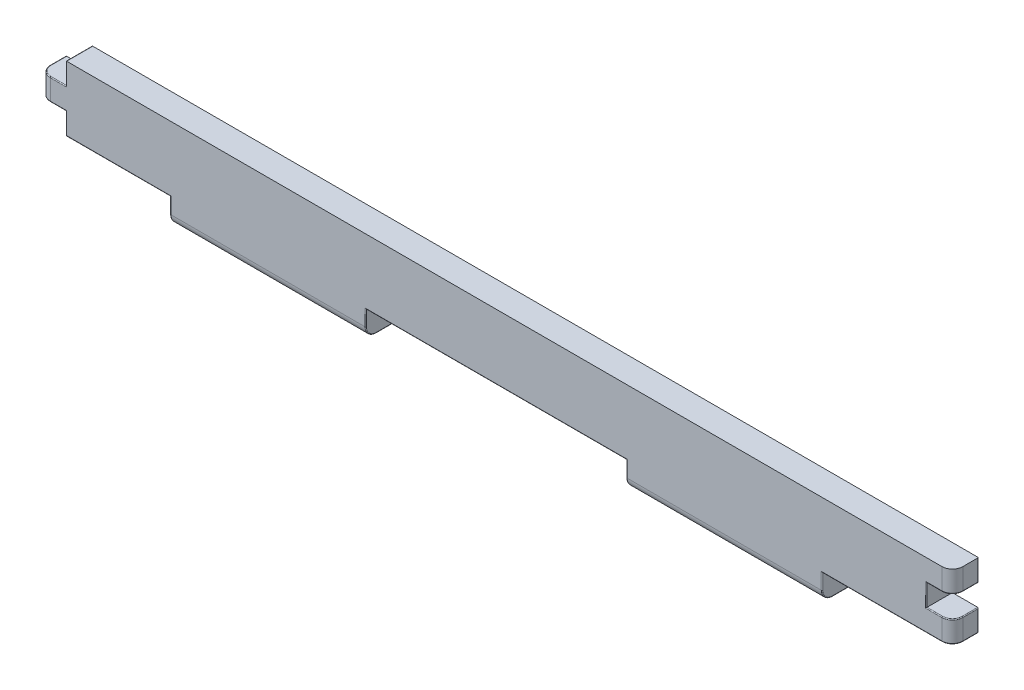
SolidWorks part; units mm, degrees
ref_plane "Front Plane" through (0, 0, 0) normal (0, 0, 1) x (1, 0, 0)
ref_plane "Top Plane" through (0, 0, 0) normal (0, 1, 0) x (1, 0, 0)
ref_plane "Right Plane" through (0, 0, 0) normal (1, 0, 0) x (0, 0, -1)
sketch "Sketch1" plane through (0, 0, 0) normal (0, 0, 1) x (1, 0, 0)
  line L1 (175, -17.5) -> (-175, -17.5)
  line L2 (175, -17.5) -> (175, 17.5)
  line L3 (175, 17.5) -> (-175, 17.5)
  line L4 (-175, -17.5) -> (-175, 17.5)
  line L5 (175, -17.5) -> (-175, 17.5) construction
  line L6 (175, 17.5) -> (-175, -17.5) construction
  point P0 (0, 0)
  dimension "D1" = 35
  dimension "D2" = 350
extrude "Boss-Extrude1" add sketch "Sketch1" along normal blind 10 contours L3 L4 L1 L2
sketch "Sketch2" plane through (0, 0, 10) normal (0, 0, 1) x (1, 0, 0)
  line L0 (175, -17.5) -> (-175, -17.5) construction
  line L1 (-175, 17.5) -> (-165, 17.5)
  line L2 (-175, 17.5) -> (-175, 9.1667)
  line L4 (-165, 17.5) -> (-165, 9.1667)
  line L5 (-175, -17.5) -> (-125, -17.5)
  line L6 (-175, -17.5) -> (-175, -7.5)
  line L7 (-175, -7.5) -> (-125, -7.5)
  line L8 (-125, -17.5) -> (-125, -7.5)
  line L9 (-50, -17.5) -> (50, -17.5)
  line L10 (-50, -17.5) -> (-50, -7.5)
  line L11 (-50, -7.5) -> (50, -7.5)
  line L12 (50, -17.5) -> (50, -7.5)
  line L13 (175, -17.5) -> (175, 17.5) construction
  line L14 (125, -17.5) -> (175, -17.5)
  line L15 (125, -17.5) -> (125, -7.5)
  line L16 (125, -7.5) -> (175, -7.5)
  line L17 (175, -17.5) -> (175, -7.5)
  line L18 (175, 17.5) -> (-175, 17.5) construction
  line L19 (-175, -7.5) -> (-165, -7.5)
  line L20 (-175, -7.5) -> (-175, 9.1667)
  line L21 (-165, 0.8333) -> (-175, 0.8333)
  line L22 (-165, -7.5) -> (-165, 0.8333)
  line L23 (175, 9.17) -> (165, 9.17)
  line L24 (175, 9.17) -> (175, 0.84)
  line L25 (175, 0.84) -> (165, 0.84)
  line L26 (165, 0.84) -> (165, 9.17)
  line L27 (-165, 9.1667) -> (-175, 9.1667)
  point P1 (175, 12.7553)
  point P6 (0, 0)
  point P11 (0, 0)
  point P12 (0, 0)
  point P18 (0, 0)
  point P22 (-50, -12.5)
  point P40 (125, -7.5)
  point P45 (-50, -7.5)
  point P48 (-125, -7.5)
  dimension "D7" = 10
  dimension "D1" = 50
  dimension "D2" = 75
  dimension "D3" = 75
  dimension "D4" = 50
  dimension "D5" = 10
  dimension "D6" = 8.3333
  dimension "D8" = 10
  dimension "D9" = 8.33
  dimension "D10" = 8.33
extrude "Cut-Extrude1" cut sketch "Sketch2" against normal through all
fillet "Fillet1" radius 4 5 edges at (175, -3.33, 10) (175, 13.335, 10) (-175, 5, 10) (87.5, -17.5, 10) (-87.5, -17.5, 10)
fillet "Fillet2" radius 0.3 36 edges at (168, 0.84, 10) (173.8284, 0.84, 8.8284) (168, 9.17, 10) (173.8284, 9.17, 8.8284) (175, -7.5, 3) (173.8284, -7.5, 8.8284) (-168, 0.8333, 10) (-173.8284, 0.8333, 8.8284) (-168, 9.1667, 10) (-173.8284, 9.1667, 8.8284) (-165, -3.3333, 10) (-165, 13.3333, 10) (165, 5.005, 10) (175, 13.335, 0) (175, -3.33, 0) (175, 0.84, 3) (175, 9.17, 3) (148, -7.5, 10) (0, -7.5, 10) (-145, -7.5, 10) (-175, 5, 0) (-175, 0.8333, 3) (-175, 9.1667, 3) (50, -17.5, 3) (50, -16.3284, 8.8284) (125, -17.5, 3) (125, -16.3284, 8.8284) (-50, -17.5, 3) (-50, -16.3284, 8.8284) (-125, -17.5, 3) (-125, -16.3284, 8.8284) (50, -10.5, 10) (125, -10.5, 10) (-50, -10.5, 10) (-125, -10.5, 10) (-165, 17.5, 5)
